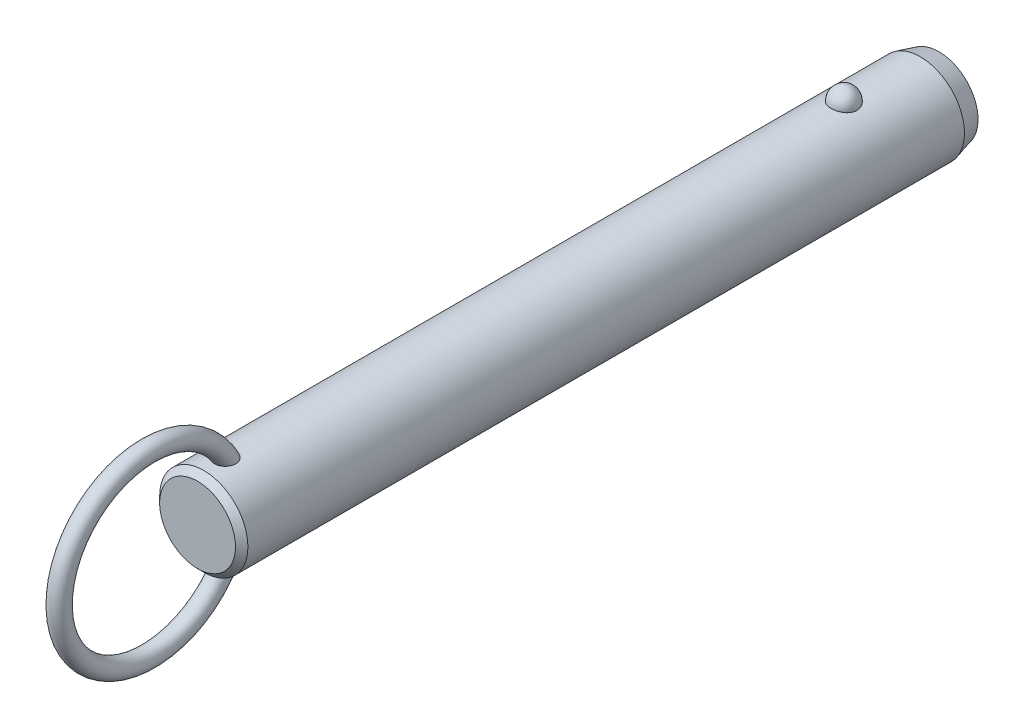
SolidWorks part; units mm, degrees
ref_plane "Front Plane" through (0, 0, 0) normal (0, 0, 1) x (1, 0, 0)
ref_plane "Top Plane" through (0, 0, 0) normal (0, 1, 0) x (1, 0, 0)
ref_plane "Right Plane" through (0, 0, 0) normal (1, 0, 0) x (0, 0, -1)
sketch "Sketch2" plane through (0, 0, 0) normal (0, 0, 1) x (1, 0, 0)
  circle A0 centre (0, 0) radius 7.1
  point P3 (0, 7.1)
  dimension "D1" = 14.2
extrude "Boss-Extrude1" add sketch "Sketch2" along normal blind 94
sketch "Sketch3" plane through (0, 0, 0) normal (0, 0, -1) x (-1, 0, 0)
  circle A0 centre (0, 0) radius 7.1
  dimension "D1" = 14.2
extrude "Boss-Extrude2" add sketch "Sketch3" along normal blind 17.4
chamfer "Chamfer1" distance 3 angle 15 1 edges at (-7.1, 0, -17.4)
sketch "Sketch12" plane through (0, 0, 0) normal (1, 0, 0) x (0, 0, -1)
  line L0 (-94, 7.1) -> (-94, -7.1) construction
  point P0 (-94, 0)
sketch "Sketch13" plane through (0, 0, 0) normal (1, 0, 0) x (0, 0, -1)
  circle A0 centre (-109.85, 0) radius 15.85
  point P2 (-94, 0)
  dimension "D1" = 31.7
sketch "Sketch14" plane through (0, 0, 0) normal (0, 1, 0) x (1, 0, 0)
  circle A0 centre (0, -95.5) radius 1.5
  point P2 (0, -94)
  dimension "D1" = 3
sweep "Sweep1" add profiles "Sketch14" path "Sketch13"
sketch "Sketch15" plane through (0, 0, 94) normal (0, 0, 1) x (1, 0, 0)
  circle A0 centre (0, 0) radius 7.1
  dimension "D1" = 14.2
extrude "Boss-Extrude3" add sketch "Sketch15" along normal blind 7.92
chamfer "Chamfer2" distance 1 angle 45 1 edges at (7.1, 0, 101.92)
sketch "Sketch18" plane through (0, 0, 0) normal (1, 0, 0) x (0, 0, -1)
  line L0 (14.4, 7.1) -> (-95.6792, 7.1) construction
  line L1 (2.1, 9.2) -> (2.1, 5)
  line L2 (-95.6792, -7.1) -> (14.4, -7.1) construction
  arc A0 (2.1, 9.2) -> (2.1, 5) centre (2.1, 7.1) ccw
  point P4 (0, 7.1)
  dimension "D1" = 16.3
revolve "Revolve1" add sketch "Sketch18" angle 360 about L1
